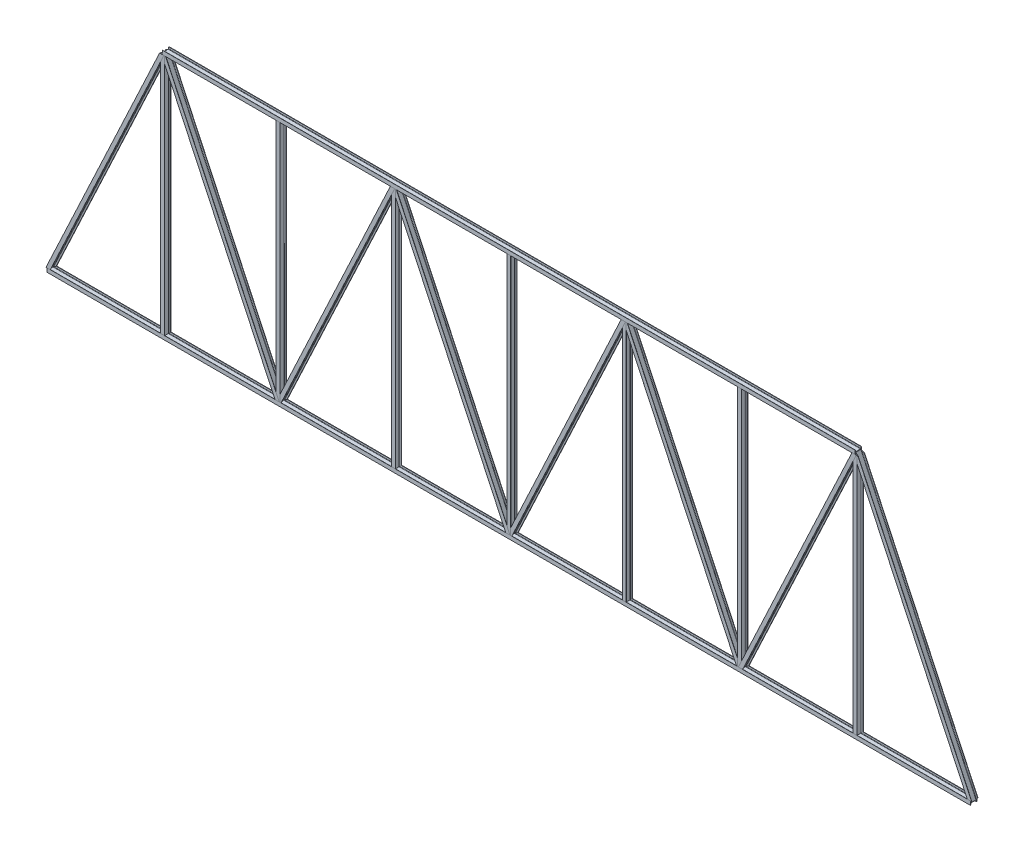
SolidWorks part; units mm, degrees
ref_plane "Front Plane" through (0, 0, 0) normal (0, 0, 1) x (1, 0, 0)
ref_plane "Top Plane" through (0, 0, 0) normal (0, 1, 0) x (1, 0, 0)
ref_plane "Right Plane" through (0, 0, 0) normal (1, 0, 0) x (0, 0, -1)
sketch "Sketch1" plane through (0, 0, 0) normal (0, 0, 1) x (1, 0, 0)
  line L0 (-9144, 0) -> (9144, 0)
  line L1 (-6858, 4876.8) -> (6858, 4876.8)
  line L2 (0, 4876.8) -> (0, 0)
  line L3 (-9144, 0) -> (-6858, 4876.8)
  line L4 (-6858, 4876.8) -> (-4572, 0)
  line L5 (-4572, 0) -> (-2286, 4876.8)
  line L6 (-2286, 4876.8) -> (0, 0)
  line L7 (0, 0) -> (2286, 4876.8)
  line L8 (2286, 4876.8) -> (4572, 0)
  line L9 (4572, 0) -> (6858, 4876.8)
  line L10 (6858, 4876.8) -> (9144, 0)
  line L11 (-6858, 4876.8) -> (-6858, 0)
  line L12 (-4572, 0) -> (-4572, 4876.8)
  line L13 (-2286, 4876.8) -> (-2286, 0)
  line L14 (2286, 4876.8) -> (2286, 0)
  line L15 (4572, 0) -> (4572, 4876.8)
  line L16 (6858, 4876.8) -> (6858, 0)
  dimension "D1" = 18288
  dimension "D2" = 4876.8
other "Structural Member1"
ref_plane "Plane1" through (6858, 4876.8, 0) normal (0.4244, -0.9055, 0) x (0.9055, 0.4244, 0)
sketch "Sketch11" plane through (6858, 4876.8, 0) normal (0.4244, -0.9055, 0) x (0.9055, 0.4244, 0)
  line L0 (-38.1, -63.5) -> (-38.1, -60.9617)
  line L1 (-35.3409, -57.7046) -> (-9.2972, -53.3637)
  line L2 (-2.7178, -45.5968) -> (-2.7178, 45.5968)
  line L3 (-9.2972, 53.3637) -> (-35.3409, 57.7046)
  line L4 (-38.1, 60.9617) -> (-38.1, 63.5)
  line L5 (-38.1, 63.5) -> (38.1, 63.5)
  line L6 (38.1, 63.5) -> (38.1, 60.9617)
  line L7 (35.3409, 57.7046) -> (9.2972, 53.3637)
  line L8 (2.7178, 45.5968) -> (2.7178, -45.5968)
  line L9 (9.2972, -53.3637) -> (35.3409, -57.7046)
  line L10 (38.1, -60.9617) -> (38.1, -63.5)
  line L11 (38.1, -63.5) -> (-38.1, -63.5)
  line L15 (-2.7178, 0) -> (2.7178, 0) construction
  arc A0 (-9.2972, -53.3637) -> (-2.7178, -45.5968) centre (-10.5918, -45.5968) ccw
  arc A1 (-2.7178, 45.5968) -> (-9.2972, 53.3637) centre (-10.5918, 45.5968) ccw
  arc A2 (9.2972, 53.3637) -> (2.7178, 45.5968) centre (10.5918, 45.5968) ccw
  arc A3 (2.7178, -45.5968) -> (9.2972, -53.3637) centre (10.5918, -45.5968) ccw
  arc A4 (-35.3409, 57.7046) -> (-38.1, 60.9617) centre (-34.798, 60.9617) cw
  arc A5 (35.3409, 57.7046) -> (38.1, 60.9617) centre (34.798, 60.9617) ccw
  arc A6 (-38.1, -60.9617) -> (-35.3409, -57.7046) centre (-34.798, -60.9617) cw
  arc A7 (38.1, -60.9617) -> (35.3409, -57.7046) centre (34.798, -60.9617) ccw
  point P1 (0, 63.5)
  point P8 (0, -63.5)
  point P21 (0, 0)
  point P34 (0, 0)
  dimension "D7" = 9.463
  dimension "RI" = 7.874
  dimension "D2" = 3.302
  dimension "BF" = 76.2
  dimension "DEPTH" = 127
  dimension "TW" = 5.4356
  dimension "D1" = 91.1936
other "Structural Member2"
ref_plane "Plane2" through (6858, 4876.8, 0) normal (0, -1, 0) x (1, 0, 0)
sketch "Sketch12" plane through (6858, 4876.8, 0) normal (0, -1, 0) x (1, 0, 0)
  line L0 (-38.1, -63.5) -> (-38.1, -60.9617)
  line L1 (-35.3409, -57.7046) -> (-9.2972, -53.3637)
  line L2 (-2.7178, -45.5968) -> (-2.7178, 45.5968)
  line L3 (-9.2972, 53.3637) -> (-35.3409, 57.7046)
  line L4 (-38.1, 60.9617) -> (-38.1, 63.5)
  line L5 (-38.1, 63.5) -> (38.1, 63.5)
  line L6 (38.1, 63.5) -> (38.1, 60.9617)
  line L7 (35.3409, 57.7046) -> (9.2972, 53.3637)
  line L8 (2.7178, 45.5968) -> (2.7178, -45.5968)
  line L9 (9.2972, -53.3637) -> (35.3409, -57.7046)
  line L10 (38.1, -60.9617) -> (38.1, -63.5)
  line L11 (38.1, -63.5) -> (-38.1, -63.5)
  line L15 (-2.7178, 0) -> (2.7178, 0) construction
  arc A0 (-9.2972, -53.3637) -> (-2.7178, -45.5968) centre (-10.5918, -45.5968) ccw
  arc A1 (-2.7178, 45.5968) -> (-9.2972, 53.3637) centre (-10.5918, 45.5968) ccw
  arc A2 (9.2972, 53.3637) -> (2.7178, 45.5968) centre (10.5918, 45.5968) ccw
  arc A3 (2.7178, -45.5968) -> (9.2972, -53.3637) centre (10.5918, -45.5968) ccw
  arc A4 (-35.3409, 57.7046) -> (-38.1, 60.9617) centre (-34.798, 60.9617) cw
  arc A5 (35.3409, 57.7046) -> (38.1, 60.9617) centre (34.798, 60.9617) ccw
  arc A6 (-38.1, -60.9617) -> (-35.3409, -57.7046) centre (-34.798, -60.9617) cw
  arc A7 (38.1, -60.9617) -> (35.3409, -57.7046) centre (34.798, -60.9617) ccw
  point P1 (0, 63.5)
  point P8 (0, -63.5)
  point P21 (0, 0)
  point P34 (0, 0)
  dimension "D7" = 9.463
  dimension "RI" = 7.874
  dimension "D2" = 3.302
  dimension "BF" = 76.2
  dimension "DEPTH" = 127
  dimension "TW" = 5.4356
  dimension "D1" = 91.1936
other "Structural Member3"
ref_plane "Plane3" through (-6858, 4876.8, 0) normal (1, 0, 0) x (0, 1, 0)
sketch "Sketch13" plane through (-6858, 4876.8, 0) normal (1, 0, 0) x (0, 1, 0)
  line L0 (-38.1, -63.5) -> (-38.1, -60.9617)
  line L1 (-35.3409, -57.7046) -> (-9.2972, -53.3637)
  line L2 (-2.7178, -45.5968) -> (-2.7178, 45.5968)
  line L3 (-9.2972, 53.3637) -> (-35.3409, 57.7046)
  line L4 (-38.1, 60.9617) -> (-38.1, 63.5)
  line L5 (-38.1, 63.5) -> (38.1, 63.5)
  line L6 (38.1, 63.5) -> (38.1, 60.9617)
  line L7 (35.3409, 57.7046) -> (9.2972, 53.3637)
  line L8 (2.7178, 45.5968) -> (2.7178, -45.5968)
  line L9 (9.2972, -53.3637) -> (35.3409, -57.7046)
  line L10 (38.1, -60.9617) -> (38.1, -63.5)
  line L11 (38.1, -63.5) -> (-38.1, -63.5)
  line L15 (-2.7178, 0) -> (2.7178, 0) construction
  arc A0 (-9.2972, -53.3637) -> (-2.7178, -45.5968) centre (-10.5918, -45.5968) ccw
  arc A1 (-2.7178, 45.5968) -> (-9.2972, 53.3637) centre (-10.5918, 45.5968) ccw
  arc A2 (9.2972, 53.3637) -> (2.7178, 45.5968) centre (10.5918, 45.5968) ccw
  arc A3 (2.7178, -45.5968) -> (9.2972, -53.3637) centre (10.5918, -45.5968) ccw
  arc A4 (-35.3409, 57.7046) -> (-38.1, 60.9617) centre (-34.798, 60.9617) cw
  arc A5 (35.3409, 57.7046) -> (38.1, 60.9617) centre (34.798, 60.9617) ccw
  arc A6 (-38.1, -60.9617) -> (-35.3409, -57.7046) centre (-34.798, -60.9617) cw
  arc A7 (38.1, -60.9617) -> (35.3409, -57.7046) centre (34.798, -60.9617) ccw
  point P1 (0, 63.5)
  point P8 (0, -63.5)
  point P21 (0, 0)
  point P34 (0, 0)
  dimension "D7" = 9.463
  dimension "RI" = 7.874
  dimension "D2" = 3.302
  dimension "BF" = 76.2
  dimension "DEPTH" = 127
  dimension "TW" = 5.4356
  dimension "D1" = 91.1936
other "Trim/Extend1"
